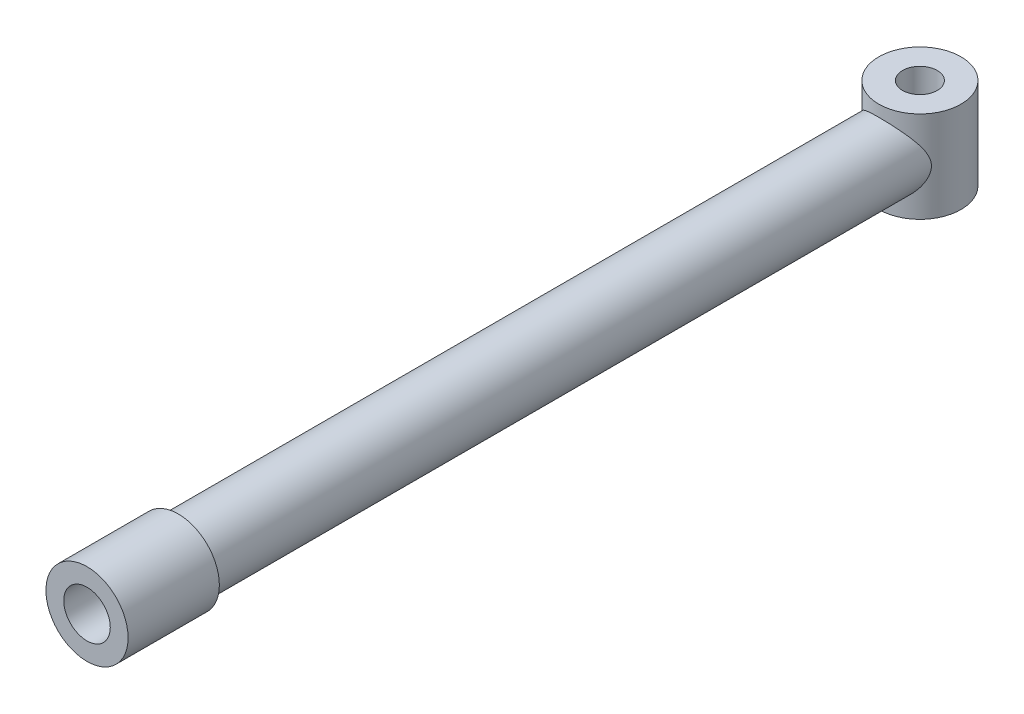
SolidWorks part; units mm, degrees
ref_plane "Front Plane" through (0, 0, 0) normal (0, 0, 1) x (1, 0, 0)
ref_plane "Top Plane" through (0, 0, 0) normal (0, 1, 0) x (1, 0, 0)
ref_plane "Right Plane" through (0, 0, 0) normal (1, 0, 0) x (0, 0, -1)
sketch "Sketch1" plane through (0, 0, 0) normal (0, 0, 1) x (1, 0, 0)
  circle A0 centre (0, 0) radius 75
  dimension "D1" = 150
extrude "Boss-Extrude1" add sketch "Sketch1" along normal mid plane 1825
sketch "Sketch2" plane through (0, 0, 912.5) normal (0, 0, 1) x (1, 0, 0)
  circle A0 centre (0, 0) radius 90
  dimension "D1" = 180
extrude "Boss-Extrude2" add sketch "Sketch2" against normal blind 200
sketch "Sketch3" plane through (0, 0, 0) normal (0, 1, 0) x (1, 0, 0)
  line L2 (-90, -912.5) -> (90, -912.5) construction
  circle A1 centre (0, 912.5) radius 90
  point P4 (0, 0)
  dimension "D1" = 1825
  dimension "D2" = 180
extrude "Boss-Extrude3" add sketch "Sketch3" along normal mid plane 200
sketch "Sketch4" plane through (0, 0, 912.5) normal (0, 0, 1) x (1, 0, 0)
  circle A0 centre (0, 0) radius 51
  dimension "D1" = 102
extrude "Cut-Extrude1" cut sketch "Sketch4" against normal blind 1735
sketch "Sketch5" plane through (0, 100, 0) normal (0, 1, 0) x (1, 0, 0)
  circle A0 centre (0, 912.5) radius 38
  dimension "D1" = 76
extrude "Cut-Extrude2" cut sketch "Sketch5" against normal through all
